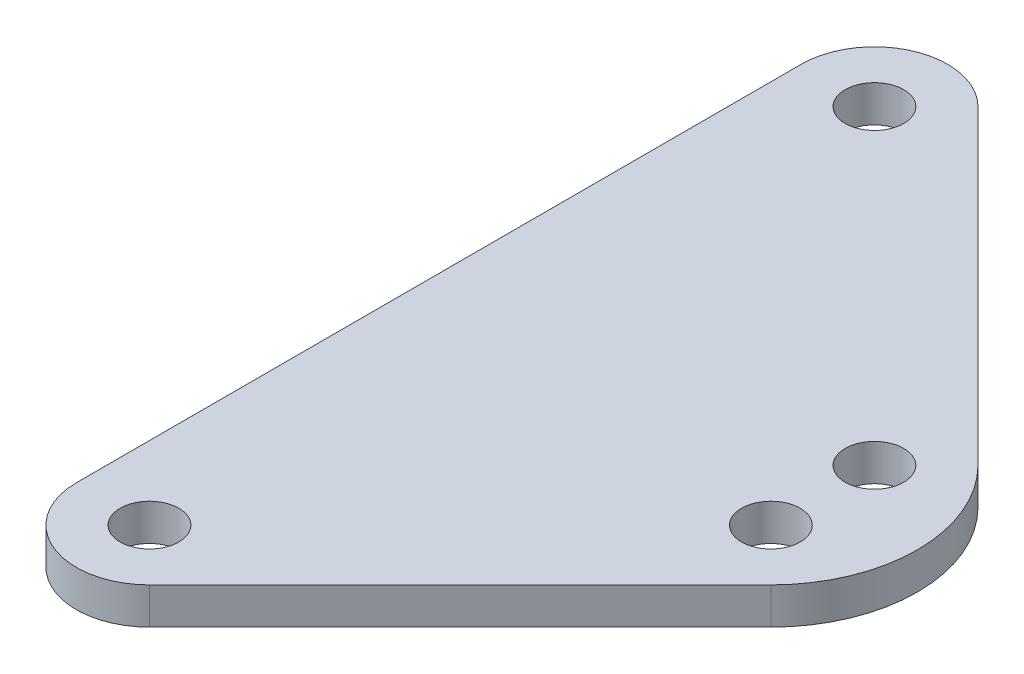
SolidWorks part; units mm, degrees
ref_plane "Front Plane" through (0, 0, 0) normal (0, 0, 1) x (1, 0, 0)
ref_plane "Top Plane" through (0, 0, 0) normal (0, 1, 0) x (1, 0, 0)
ref_plane "Right Plane" through (0, 0, 0) normal (1, 0, 0) x (0, 0, -1)
sketch "Sketch1" plane through (0, 0, 0) normal (0, 1, 0) x (1, 0, 0)
  line L0 (34.1421, 34.1421) -> (118.9949, 118.9949)
  line L1 (118.9949, 175.5635) -> (34.1421, 260.4163)
  line L2 (0, 246.2742) -> (0, 48.2843)
  circle A0 centre (20, 48.2843) radius 8
  circle A1 centre (104.8528, 133.1371) radius 8
  circle A2 centre (104.8528, 161.4214) radius 8
  circle A3 centre (20, 246.2742) radius 8
  arc A4 (118.9949, 118.9949) -> (118.9949, 175.5635) centre (90.7107, 147.2792) ccw
  arc A5 (34.1421, 260.4163) -> (0, 246.2742) centre (20, 246.2742) ccw
  arc A6 (34.1421, 34.1421) -> (0, 48.2843) centre (20, 48.2843) cw
  point P12 (-14.5741, 186.8364)
  point P13 (0, 0)
  point P14 (-23.9885, 4.2958)
  point P15 (89.0917, 89.0917)
  point P16 (146.282, 124.0072)
  point P17 (77.7817, 106.066)
  point P18 (60.8643, 123.1235)
  point P19 (105.075, 133.3593)
  point P20 (95.2365, 159.3219)
  point P21 (107.2973, 135.5816)
  point P22 (98.8614, 129.0396)
  point P23 (19.7434, 48.6078)
  point P24 (20.2559, 48.5402)
  point P31 (0, 0)
  dimension "D3" = 16
  dimension "D4" = 16
  dimension "D5" = 16
  dimension "D6" = 16
  dimension "D16" = 40
  dimension "D17" = 20
  dimension "D2" = 40
  dimension "D7" = 120
  dimension "D8" = 120
  dimension "D9" = 20
  dimension "D10" = 45
  dimension "D11" = 20
  dimension "D12" = 20
  dimension "D13" = 20
  dimension "D14" = 40
  dimension "D15" = 20
extrude "Boss-Extrude1" add sketch "Sketch1" along normal blind 10
